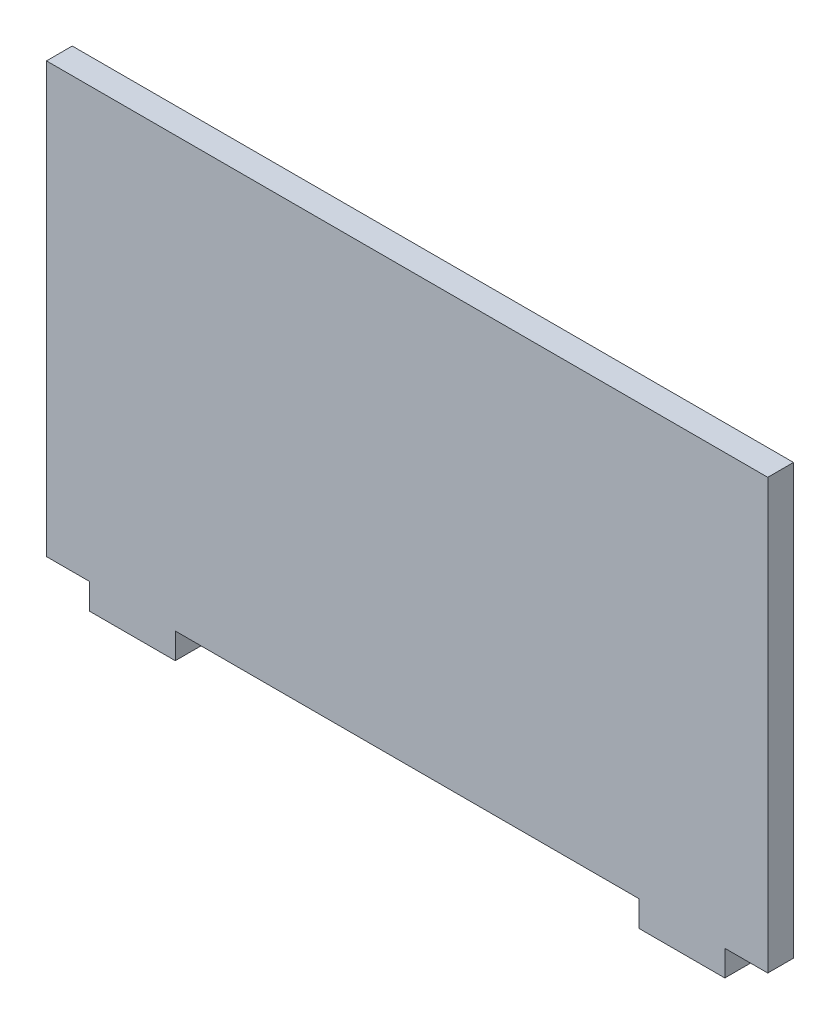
SolidWorks part; units mm, degrees
ref_plane "Plano frontal" through (0, 0, 0) normal (0, 0, 1) x (1, 0, 0)
ref_plane "Plano superior" through (0, 0, 0) normal (0, 1, 0) x (1, 0, 0)
ref_plane "Plano direito" through (0, 0, 0) normal (1, 0, 0) x (0, 0, -1)
sketch "Esboço2" plane through (0, 0, 0) normal (0, 0, 1) x (1, 0, 0)
  line L1 (85.9047, -8.9716) -> (85.9047, 41.0284)
  line L2 (85.9047, 41.0284) -> (1.9047, 41.0284)
  line L3 (1.9047, 41.0284) -> (1.9047, -8.9716)
  line L4 (1.9047, -8.9716) -> (6.9047, -8.9716)
  line L5 (6.9047, -8.9716) -> (6.9047, -11.9716)
  line L6 (6.9047, -11.9716) -> (16.9047, -11.9716)
  line L7 (16.9047, -11.9716) -> (16.9047, -8.9716)
  line L8 (85.9047, -8.9716) -> (80.9047, -8.9716)
  line L9 (80.9047, -8.9716) -> (80.9047, -11.9716)
  line L10 (80.9047, -11.9716) -> (70.9047, -11.9716)
  line L11 (70.9047, -11.9716) -> (70.9047, -8.9716)
  line L12 (16.9047, -8.9716) -> (70.9047, -8.9716)
extrude "Ressalto-extrusão1" add sketch "Esboço2" along normal blind 3
